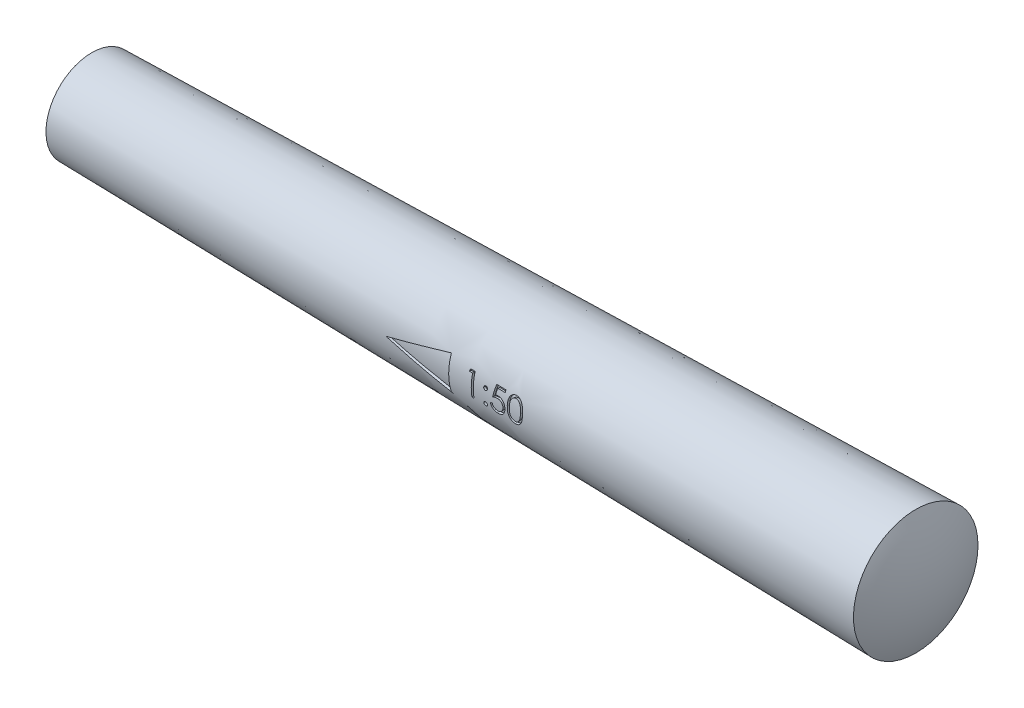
SolidWorks part; units mm, degrees
ref_plane "Front Plane" through (0, 0, 0) normal (0, 0, 1) x (1, 0, 0)
ref_plane "Top Plane" through (0, 0, 0) normal (0, 1, 0) x (1, 0, 0)
ref_plane "Right Plane" through (0, 0, 0) normal (1, 0, 0) x (0, 0, -1)
sketch "Sketch1" plane through (0, 0, 0) normal (1, 0, 0) x (0, 0, -1)
  circle A0 centre (0, 0) radius 2
  dimension "D1" = 4
extrude "Extrude1" add sketch "Sketch1" along normal mid plane 36
draft "Draft1" type of draft neutral plane draft angle 1.146 faces to draft 1 parameters "D1"=1.146
sketch "Sketch2" plane through (0, 0, 0) normal (0, 0, 1) x (1, 0, 0)
  line L0 (-18, 0) -> (-18, 2)
  line L1 (-18, 2) -> (-18, -2) construction
  line L2 (-18, 0) -> (-18.6, 0)
  line L3 (-18.6, 0) -> (-18.6, -2.36) construction
  line L4 (18, 0) -> (18, 2.72)
  line L5 (18, -2.72) -> (18, 2.72) construction
  line L6 (18, 0) -> (18.6, 0)
  line L7 (18.6, 0) -> (18.6, -2.36) construction
  line L8 (-18, -2) -> (18, -2.72) construction
  arc A0 (-18.6, 0) -> (-18, 2) centre (-14.9667, 0) cw
  arc A1 (18.6, 0) -> (18, 2.72) centre (12.1346, 0) ccw
  point P14 (0, -2.36)
revolve "Revolve1" add sketch "Sketch2" angle 360 about L2
sketch "Sketch5" plane through (0, 0, 0) normal (0, 0, 1) x (1, 0, 0)
  line L0 (0, 2.36) -> (0, -2.36) construction
  line L1 (18, 2.72) -> (-18, 2) construction
  line L2 (-18, -2) -> (18, -2.72) construction
ref_plane "Plane2" through (0, 0, 0) normal (-0.02, 0, 0.9998) x (0.9998, 0, 0.02)
sketch "Sketch6" plane through (0, 0, 0) normal (-0.02, 0, 0.9998) x (0.9998, 0, 0.02)
  line L0 (0, 0) -> (0, 0.75)
  line L1 (0, 2.36) -> (0, -2.36) construction
  line L2 (0, 0.75) -> (-2.799, 0)
  line L3 (-2.799, 0) -> (0, -0.75)
  line L4 (0, -0.75) -> (0, 0)
  line L5 (0, -0.375) -> (4, -0.375) construction
  text T0 "1:50" font "Century Gothic" height 1
  dimension "D1" = 1.5
  dimension "D2" = 30
  dimension "D3" = 4
wrap "Wrap2" sketch "Sketch6" wrap type deboss source sketch "Sketch6" thickness 0.1 parameters "D1"=0.1
equation "\"D2@Sketch2\" = \"D1@Sketch2\""
